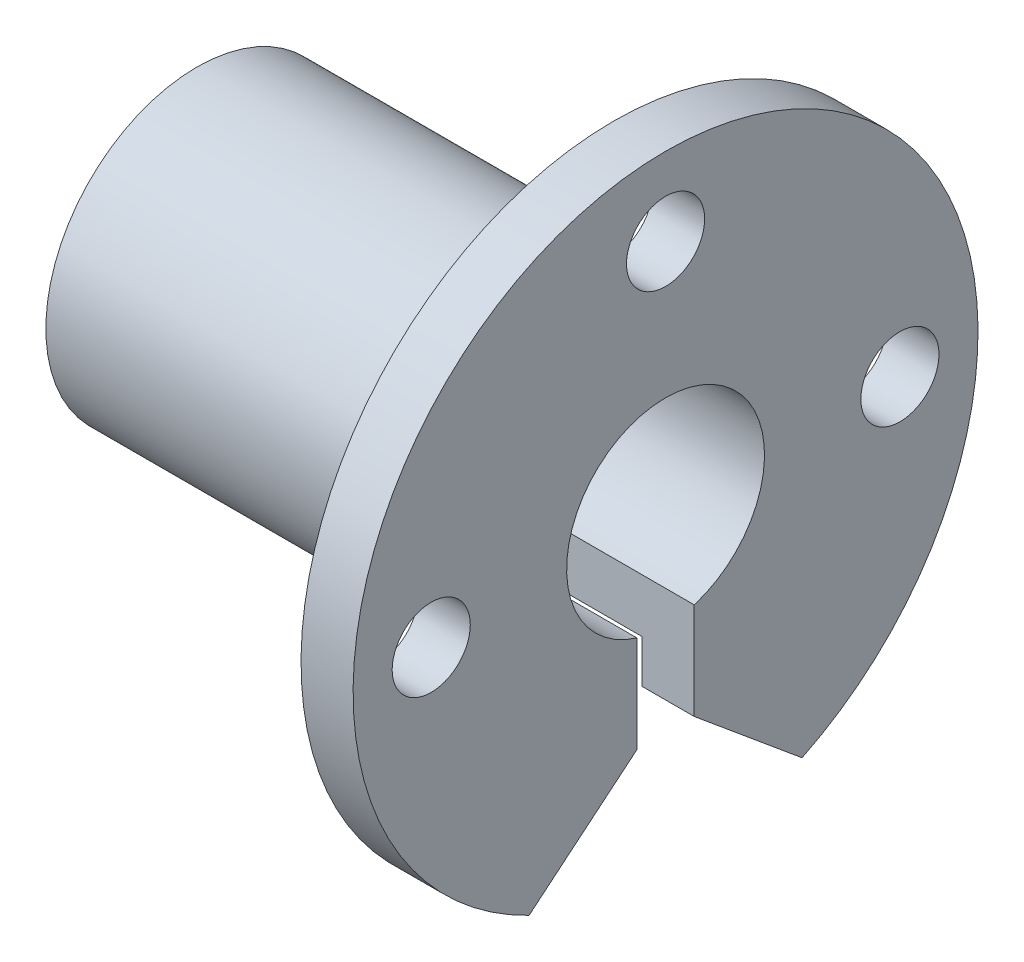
SolidWorks part; units mm, degrees
ref_plane "Plan de face" through (0, 0, 0) normal (0, 0, 1) x (1, 0, 0)
ref_plane "Plan de dessus" through (0, 0, 0) normal (0, 1, 0) x (1, 0, 0)
ref_plane "Plan de droite" through (0, 0, 0) normal (1, 0, 0) x (0, 0, -1)
sketch "Esquisse1" plane through (0, 0, 0) normal (0, 0, 1) x (1, 0, 0)
  line L0 (0, 12) -> (0, 3.8)
  line L1 (0, 3.8) -> (-16, 3.8)
  line L2 (-16, 3.8) -> (-16, 1.1)
  line L3 (-16, 1.1) -> (-18, 1.1)
  line L4 (-18, 1.1) -> (-18, 5.8)
  line L5 (-18, 5.8) -> (-2, 5.8)
  line L6 (-2, 5.8) -> (-2, 12)
  line L7 (-2, 12) -> (0, 12)
  line L8 (0, 0) -> (-90.1573, 0) construction
  dimension "D1" = 1.1
  dimension "D2" = 3.8
  dimension "D3" = 2
  dimension "D4" = 16
  dimension "D5" = 2
  dimension "D6" = 2
  dimension "D7" = 12
revolve "Révolution1" add sketch "Esquisse1" angle 360 about L8
sketch "Esquisse2" plane through (0, 0, 0) normal (0, 1, 0) x (1, 0, 0)
  line L1 (-21.4465, 1.1) -> (8.9051, 1.1)
  line L2 (-21.4465, 1.1) -> (-21.4465, -1.1)
  line L3 (-21.4465, -1.1) -> (8.9051, -1.1)
  line L4 (8.9051, 1.1) -> (8.9051, -1.1)
  dimension "D1" = 1.1
  dimension "D2" = 1.1
extrude "Enlèv. mat.-Extru.1" cut sketch "Esquisse2" against normal through all
chamfer "Chanfrein1" distance 5 angle 45 2 edges at (-1, -11.9495, -1.1) (-1, -11.9495, 1.1)
sketch "Esquisse3" plane through (-2, 0, 0) normal (-1, 0, 0) x (0, 0, 1)
  line L0 (-14.1798, 0) -> (15.7096, 0) construction
  circle A0 centre (0, 0) radius 9
  circle A1 centre (-9, 0) radius 1.5
  circle A2 centre (0, 9) radius 1.5
  circle A3 centre (9, 0) radius 1.5
extrude "Enlèv. mat.-Extru.2" cut sketch "Esquisse3" against normal blind 10 contours A0 A2 | A0 A2 | A1 L0 A0 | L0 A1 A0 | L0 A0 A1 | A0 L0 A1 | A0 L0 A3 | A3 L0 A0 | L0 A3 A0 | L0 A0 A3
